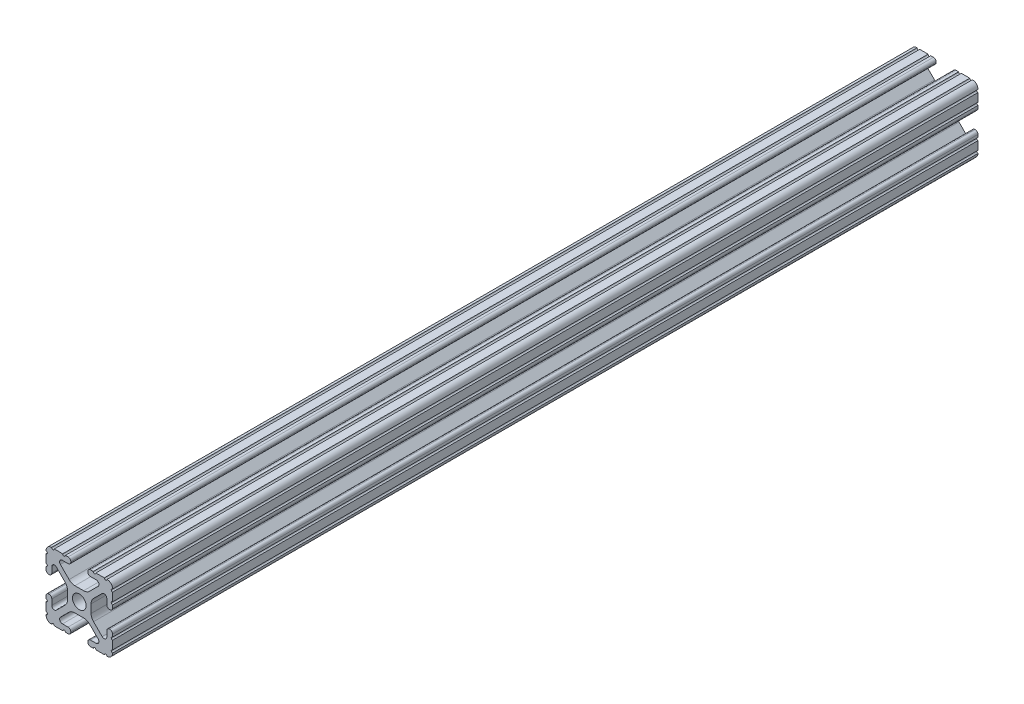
SolidWorks part; units mm, degrees
ref_plane "Front Plane" through (0, 0, 0) normal (0, 0, 1) x (1, 0, 0)
ref_plane "Top Plane" through (0, 0, 0) normal (0, 1, 0) x (1, 0, 0)
ref_plane "Right Plane" through (0, 0, 0) normal (1, 0, 0) x (0, 0, -1)
sketch "Sketch1" plane through (0, 0, 0) normal (0, 0, 1) x (1, 0, 0)
  line L88 (-7.1797, -8.6452) -> (-3.9523, -5.4237)
  line L89 (-1.7093, -4.4958) -> (1.7093, -4.4958)
  line L90 (3.9523, -5.4237) -> (7.1797, -8.6452)
  line L91 (6.4164, -10.4902) -> (4.2875, -10.4902)
  line L92 (3.2385, -11.5392) -> (3.2385, -11.651)
  line L93 (4.2875, -12.7) -> (5.3171, -12.7)
  line L94 (6.3331, -12.7) -> (9.5504, -12.7)
  line L95 (12.7, -9.5504) -> (12.7, -6.3331)
  line L96 (12.7, -5.3171) -> (12.7, -4.2875)
  line L97 (11.651, -3.2385) -> (11.5392, -3.2385)
  line L98 (10.4902, -4.2875) -> (10.4902, -6.4021)
  line L99 (8.7371, -7.1294) -> (5.441, -3.8408)
  line L100 (4.5085, -1.5932) -> (4.5085, 1.5932)
  line L101 (5.441, 3.8408) -> (8.7371, 7.1294)
  line L102 (10.4902, 6.4021) -> (10.4902, 4.2875)
  line L103 (11.5392, 3.2385) -> (11.651, 3.2385)
  line L104 (12.7, 4.2875) -> (12.7, 5.3171)
  line L105 (12.7, 6.3331) -> (12.7, 9.5504)
  line L106 (9.5504, 12.7) -> (6.3331, 12.7)
  line L107 (5.3171, 12.7) -> (4.2875, 12.7)
  line L108 (3.2385, 11.651) -> (3.2385, 11.5392)
  line L109 (4.2875, 10.4902) -> (6.4768, 10.4902)
  line L110 (7.207, 8.7244) -> (3.8983, 5.4232)
  line L111 (1.6558, 4.4958) -> (-1.6558, 4.4958)
  line L112 (-3.8983, 5.4232) -> (-7.207, 8.7244)
  line L113 (-6.4768, 10.4902) -> (-4.2875, 10.4902)
  line L114 (-3.2385, 11.5392) -> (-3.2385, 11.651)
  line L115 (-4.2875, 12.7) -> (-5.3171, 12.7)
  line L116 (-6.3331, 12.7) -> (-9.5504, 12.7)
  line L117 (-12.7, 9.5504) -> (-12.7, 6.3331)
  line L118 (-12.7, 5.3171) -> (-12.7, 4.2875)
  line L119 (-11.651, 3.2385) -> (-11.5392, 3.2385)
  line L120 (-10.4902, 4.2875) -> (-10.4902, 6.4021)
  line L121 (-8.7371, 7.1294) -> (-5.441, 3.8408)
  line L122 (-4.5085, 1.5932) -> (-4.5085, -1.5932)
  line L123 (-5.441, -3.8408) -> (-8.7371, -7.1294)
  line L124 (-10.4902, -6.4021) -> (-10.4902, -4.2875)
  line L125 (-11.5392, -3.2385) -> (-11.651, -3.2385)
  line L126 (-12.7, -4.2875) -> (-12.7, -5.3171)
  line L127 (-12.7, -6.3331) -> (-12.7, -9.5504)
  line L128 (-9.5504, -12.7) -> (-6.3331, -12.7)
  line L129 (-5.3171, -12.7) -> (-4.2875, -12.7)
  line L130 (-3.2385, -11.651) -> (-3.2385, -11.5392)
  line L131 (-4.2875, -10.4902) -> (-6.4164, -10.4902)
  circle A1 centre (0, 0) radius 2.6035
  arc A104 (-7.1797, -8.6452) -> (-6.4164, -10.4902) centre (-6.4164, -9.4098) ccw
  arc A105 (-1.7093, -4.4958) -> (-3.9523, -5.4237) centre (-1.7093, -7.6708) ccw
  arc A106 (3.9523, -5.4237) -> (1.7093, -4.4958) centre (1.7093, -7.6708) ccw
  arc A107 (6.4164, -10.4902) -> (7.1797, -8.6452) centre (6.4164, -9.4098) ccw
  arc A108 (4.2875, -10.4902) -> (3.2385, -11.5392) centre (4.2875, -11.5392) ccw
  arc A109 (3.2385, -11.651) -> (4.2875, -12.7) centre (4.2875, -11.651) ccw
  arc A110 (6.3331, -12.7) -> (5.3171, -12.7) centre (5.8251, -12.7) ccw
  arc A111 (10.5664, -12.6998) -> (9.5504, -12.7) centre (10.0584, -12.7) ccw
  arc A112 (10.5664, -12.6998) -> (12.6998, -10.5664) centre (10.5918, -10.5918) ccw
  arc A113 (12.7, -9.5504) -> (12.6998, -10.5664) centre (12.7, -10.0584) ccw
  arc A114 (12.7, -5.3171) -> (12.7, -6.3331) centre (12.7, -5.8251) ccw
  arc A115 (12.7, -4.2875) -> (11.651, -3.2385) centre (11.651, -4.2875) ccw
  arc A116 (11.5392, -3.2385) -> (10.4902, -4.2875) centre (11.5392, -4.2875) ccw
  arc A117 (8.7371, -7.1294) -> (10.4902, -6.4021) centre (9.4628, -6.4021) ccw
  arc A118 (4.5085, -1.5932) -> (5.441, -3.8408) centre (7.6835, -1.5932) ccw
  arc A119 (5.441, 3.8408) -> (4.5085, 1.5932) centre (7.6835, 1.5932) ccw
  arc A120 (10.4902, 6.4021) -> (8.7371, 7.1294) centre (9.4628, 6.4021) ccw
  arc A121 (10.4902, 4.2875) -> (11.5392, 3.2385) centre (11.5392, 4.2875) ccw
  arc A122 (11.651, 3.2385) -> (12.7, 4.2875) centre (11.651, 4.2875) ccw
  arc A123 (12.7, 6.3331) -> (12.7, 5.3171) centre (12.7, 5.8251) ccw
  arc A124 (12.6998, 10.5664) -> (12.7, 9.5504) centre (12.7, 10.0584) ccw
  arc A125 (12.6998, 10.5664) -> (10.5664, 12.6998) centre (10.5918, 10.5918) ccw
  arc A126 (9.5504, 12.7) -> (10.5664, 12.6998) centre (10.0584, 12.7) ccw
  arc A127 (5.3171, 12.7) -> (6.3331, 12.7) centre (5.8251, 12.7) ccw
  arc A128 (4.2875, 12.7) -> (3.2385, 11.651) centre (4.2875, 11.651) ccw
  arc A129 (3.2385, 11.5392) -> (4.2875, 10.4902) centre (4.2875, 11.5392) ccw
  arc A130 (7.207, 8.7244) -> (6.4768, 10.4902) centre (6.4768, 9.4563) ccw
  arc A131 (1.6558, 4.4958) -> (3.8983, 5.4232) centre (1.6558, 7.6708) ccw
  arc A132 (-3.8983, 5.4232) -> (-1.6558, 4.4958) centre (-1.6558, 7.6708) ccw
  arc A133 (-6.4768, 10.4902) -> (-7.207, 8.7244) centre (-6.4768, 9.4563) ccw
  arc A134 (-4.2875, 10.4902) -> (-3.2385, 11.5392) centre (-4.2875, 11.5392) ccw
  arc A135 (-3.2385, 11.651) -> (-4.2875, 12.7) centre (-4.2875, 11.651) ccw
  arc A136 (-6.3331, 12.7) -> (-5.3171, 12.7) centre (-5.8251, 12.7) ccw
  arc A137 (-10.5664, 12.6998) -> (-9.5504, 12.7) centre (-10.0584, 12.7) ccw
  arc A138 (-10.5664, 12.6998) -> (-12.6998, 10.5664) centre (-10.5918, 10.5918) ccw
  arc A139 (-12.7, 9.5504) -> (-12.6998, 10.5664) centre (-12.7, 10.0584) ccw
  arc A140 (-12.7, 5.3171) -> (-12.7, 6.3331) centre (-12.7, 5.8251) ccw
  arc A141 (-12.7, 4.2875) -> (-11.651, 3.2385) centre (-11.651, 4.2875) ccw
  arc A142 (-11.5392, 3.2385) -> (-10.4902, 4.2875) centre (-11.5392, 4.2875) ccw
  arc A143 (-8.7371, 7.1294) -> (-10.4902, 6.4021) centre (-9.4628, 6.4021) ccw
  arc A144 (-4.5085, 1.5932) -> (-5.441, 3.8408) centre (-7.6835, 1.5932) ccw
  arc A145 (-5.441, -3.8408) -> (-4.5085, -1.5932) centre (-7.6835, -1.5932) ccw
  arc A146 (-10.4902, -6.4021) -> (-8.7371, -7.1294) centre (-9.4628, -6.4021) ccw
  arc A147 (-10.4902, -4.2875) -> (-11.5392, -3.2385) centre (-11.5392, -4.2875) ccw
  arc A148 (-11.651, -3.2385) -> (-12.7, -4.2875) centre (-11.651, -4.2875) ccw
  arc A149 (-12.7, -6.3331) -> (-12.7, -5.3171) centre (-12.7, -5.8251) ccw
  arc A150 (-12.6998, -10.5664) -> (-12.7, -9.5504) centre (-12.7, -10.0584) ccw
  arc A151 (-12.6998, -10.5664) -> (-10.5664, -12.6998) centre (-10.5918, -10.5918) ccw
  arc A152 (-9.5504, -12.7) -> (-10.5664, -12.6998) centre (-10.0584, -12.7) ccw
  arc A153 (-5.3171, -12.7) -> (-6.3331, -12.7) centre (-5.8251, -12.7) ccw
  arc A154 (-4.2875, -12.7) -> (-3.2385, -11.651) centre (-4.2875, -11.651) ccw
  arc A155 (-3.2385, -11.5392) -> (-4.2875, -10.4902) centre (-4.2875, -11.5392) ccw
extrude "Boss-Extrude1" add sketch "Sketch1" along normal mid plane 330.2
